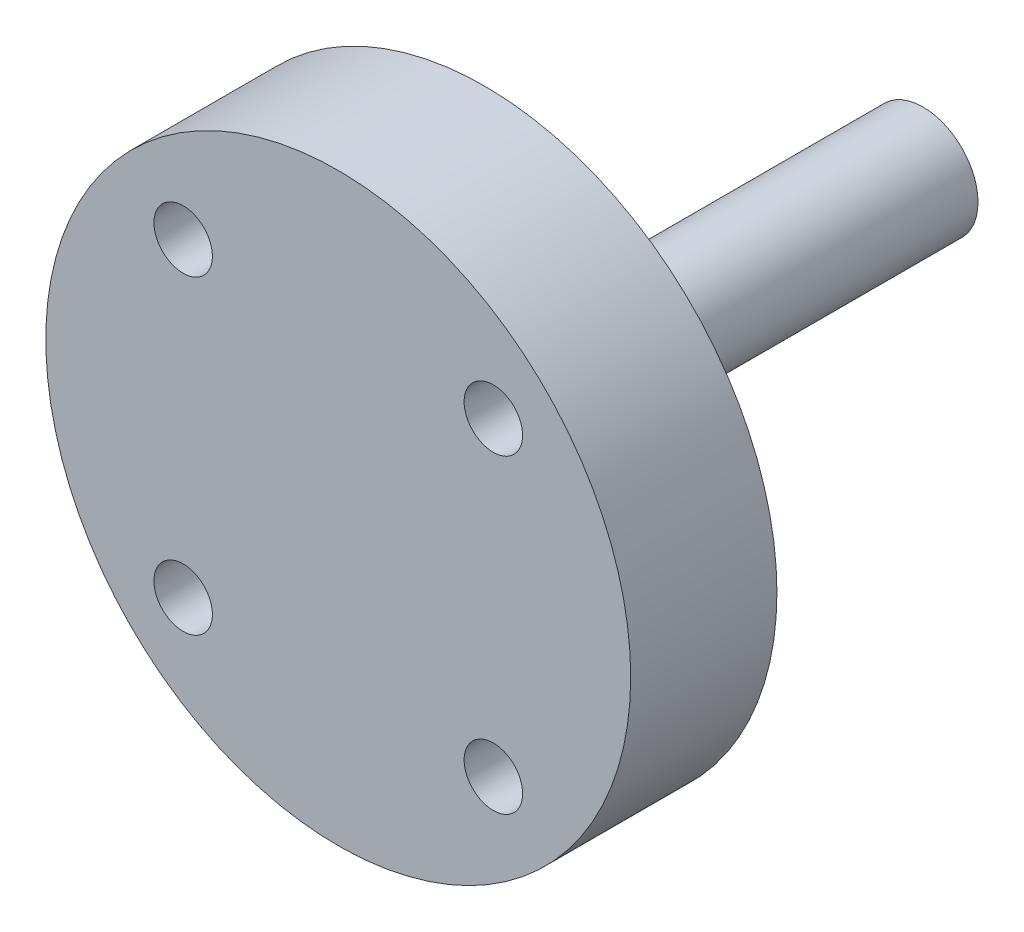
SolidWorks part; units mm, degrees
ref_plane "Face" through (0, 0, 0) normal (0, 0, 1) x (1, 0, 0)
ref_plane "Dessus" through (0, 0, 0) normal (0, 1, 0) x (1, 0, 0)
ref_plane "Droite" through (0, 0, 0) normal (1, 0, 0) x (0, 0, -1)
sketch "Esquisse2" plane through (0, 0, 0) normal (0, 0, 1) x (1, 0, 0)
  circle A0 centre (0, 0) radius 7.5
  dimension "D1" = 15
extrude "Base-Extrusion" add sketch "Esquisse2" along normal blind 60
sketch "Esquisse4" plane through (0, 0, 60) normal (0, 0, 1) x (1, 0, 0)
  circle A0 centre (0, 0) radius 40
  circle A1 centre (0, 0) radius 7.5 construction
  dimension "D1" = 80
extrude "Boss.-Extru.2" add sketch "Esquisse4" along normal blind 20
sketch "Esquisse5" plane through (0, 0, 80) normal (0, 0, 1) x (1, 0, 0)
  line L0 (0, 0) -> (0, 38.8958) construction
  line L1 (0, 0) -> (-33.5914, 33.5914) construction
  circle A0 centre (0, 0) radius 30 construction
  circle A1 centre (-21.2132, 21.2132) radius 4
  dimension "D1" = 60
  dimension "D3" = 8
  dimension "D2" = 45
extrude "Enlèv. mat.-Extru.1" cut sketch "Esquisse5" against normal through all
pattern_circular "Répétition circulaire1" count 4 over 360
